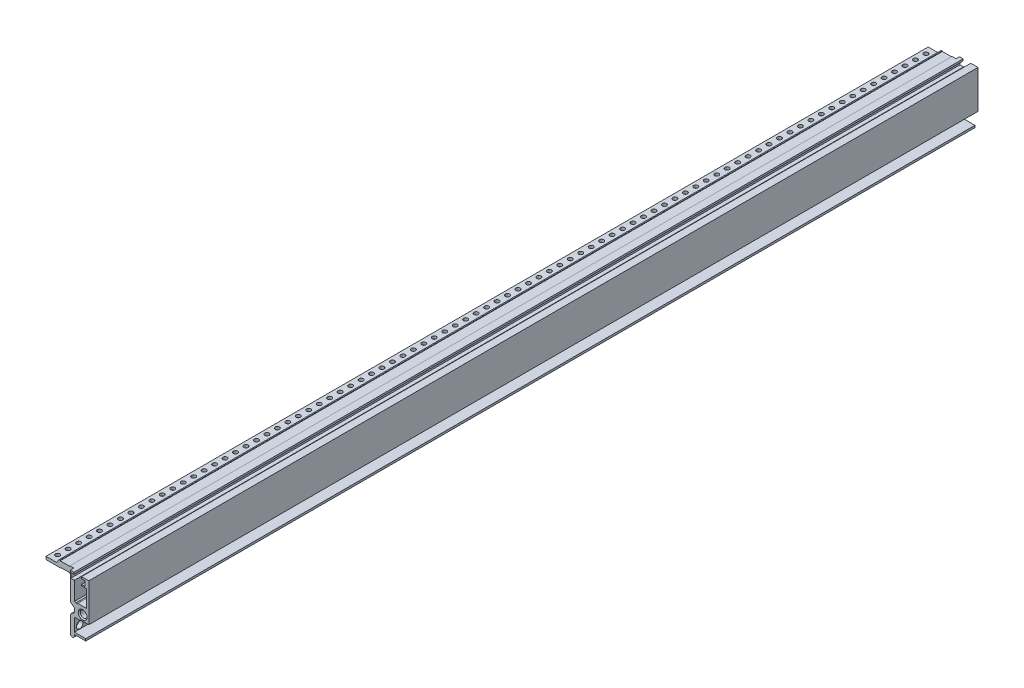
SolidWorks part; units mm, degrees
ref_plane "前视基准面" through (0, 0, 0) normal (0, 0, 1) x (1, 0, 0)
ref_plane "上视基准面" through (0, 0, 0) normal (0, 1, 0) x (1, 0, 0)
ref_plane "右视基准面" through (0, 0, 0) normal (1, 0, 0) x (0, 0, -1)
sketch "Model" plane through (0, 0, 0) normal (0, 0, 1) x (1, 0, 0)
  line L0 (2281.8705, 1522.2598) -> (2281.8705, 1503.7598)
  line L1 (2277.6705, 1503.7598) -> (2277.6705, 1503.4598)
  line L2 (2280.6205, 1518.3598) -> (2280.6205, 1510.0598)
  line L3 (2278.3705, 1522.2598) -> (2278.3705, 1521.3598)
  line L4 (2274.6705, 1522.2598) -> (2274.6705, 1521.3598)
  line L5 (2270.9705, 1522.2598) -> (2270.9705, 1522.0098)
  line L6 (2281.8705, 1522.2598) -> (2278.3705, 1522.2598)
  line L7 (2281.8705, 1503.7598) -> (2277.6705, 1503.7598)
  line L8 (2280.3705, 1496.1598) -> (2274.8705, 1496.1598)
  line L9 (2280.3705, 1497.1598) -> (2274.8705, 1497.1598)
  line L10 (2280.6205, 1518.3598) -> (2278.2705, 1518.3598)
  line L11 (2280.6205, 1510.0598) -> (2276.5105, 1510.0598)
  line L12 (2275.8305, 1510.0598) -> (2274.8705, 1510.0598)
  line L13 (2279.9205, 1518.9598) -> (2278.2705, 1518.9598)
  line L14 (2279.9205, 1521.3598) -> (2278.3705, 1521.3598)
  line L15 (2274.6705, 1522.2598) -> (2270.9705, 1522.2598)
  line L16 (2266.5705, 1519.0598) -> (2259.3705, 1519.0598)
  line L17 (2270.9705, 1519.3098) -> (2266.5705, 1519.3098)
  line L18 (2264.5705, 1520.4598) -> (2259.3705, 1520.4598)
  line L19 (2270.9705, 1522.0098) -> (2266.2705, 1522.0098)
  line L20 (2259.3705, 1520.4598) -> (2259.3705, 1519.0598)
  line L21 (2266.5705, 1519.3098) -> (2266.5705, 1519.0598)
  line L22 (2266.2705, 1522.2598) -> (2266.2705, 1522.0098)
  line L23 (2266.2705, 1522.2598) -> (2265.7705, 1522.2598)
  line L24 (2272.8705, 1516.5598) -> (2272.8705, 1508.9598)
  line L25 (2272.8705, 1503.7598) -> (2272.8705, 1495.5598)
  line L26 (2280.3705, 1497.1598) -> (2280.3705, 1496.1598)
  line L27 (2274.8705, 1496.1598) -> (2274.8705, 1495.5598)
  line L28 (2274.8705, 1507.3598) -> (2274.8705, 1505.3598)
  line L29 (2274.6705, 1521.3598) -> (2273.1205, 1521.3598)
  line L30 (2279.9205, 1521.3598) -> (2279.9205, 1518.9598)
  line L31 (2273.1205, 1521.3598) -> (2273.1205, 1518.9598)
  line L32 (2274.8705, 1518.9598) -> (2273.1205, 1518.9598)
  line L33 (2270.9705, 1519.3098) -> (2270.9705, 1519.0598)
  line L34 (2278.2705, 1518.9598) -> (2278.2705, 1518.3598)
  line L35 (2272.8705, 1508.9598) -> (2274.8705, 1507.3598)
  line L36 (2274.8705, 1505.3598) -> (2272.8705, 1503.7598)
  line L37 (2274.8705, 1518.9598) -> (2274.8705, 1510.0598)
  line L38 (2277.6705, 1503.4598) -> (2274.8705, 1503.4598)
  line L39 (2274.8705, 1497.1598) -> (2274.8705, 1503.4598)
  line L43 (2264.5705, 1520.4598) -> (2265.7705, 1522.2598)
  line L44 (2270.9705, 1519.0598) -> (2272.8705, 1516.5598)
  arc A0 (2275.8305, 1510.0598) -> (2276.5105, 1510.0598) centre (2276.1705, 1510.0598) ccw
  arc A1 (2272.8705, 1495.5598) -> (2274.8705, 1495.5598) centre (2273.8705, 1495.5598) ccw
extrude "凸台-拉伸1" add sketch "Model" along normal blind 431.8
hole_wizard "M4 螺纹孔1" positions "草图3" profile "草图2" tap size "M4" standard "Gb"
sketch "草图3" plane through (0, 0, 431.8) normal (0, 0, 1) x (1, 0, 0)
  line L0 (2281.8705, 1503.7598) -> (2281.8705, 1522.2598) construction
  line L1 (2281.8705, 1522.2598) -> (2278.3705, 1522.2598) construction
  point P0 (2278.8705, 1506.4598)
  dimension "D1" = 3
  dimension "D2" = 15.8
sketch "草图2" plane through (2278.8705, 1506.4598, 431.8) normal (1, 0, 0) x (0, -1, 0)
  line L0 (0, 0) -> (0, 24.4914)
  line L1 (0, 24.4914) -> (1.65, 23.5)
  line L2 (1.65, 23.5) -> (1.65, 0)
  line L5 (1.65, 0) -> (0, 0)
  line L10 (0, 24.4914) -> (-1.65, 23.5) construction
  line L11 (0, -6.35) -> (0, 107.95) construction
  dimension "螺纹孔钻头直径" = 3.3
  dimension "螺纹孔钻头深度" = 23.5
  dimension "导头角度" = 118
hole_wizard "M4 螺纹孔2" positions "草图5" profile "草图4" tap size "M4" standard "Gb"
sketch "草图5" plane through (0, 0, 0) normal (0, 0, -1) x (-1, 0, 0)
  line L0 (-2281.8705, 1503.7598) -> (-2281.8705, 1522.2598) construction
  line L1 (-2281.8705, 1522.2598) -> (-2278.3705, 1522.2598) construction
  point P0 (-2278.8705, 1506.4598)
  dimension "D1" = 3
  dimension "D2" = 15.8
sketch "草图4" plane through (2278.8705, 1506.4598, 0) normal (1, 0, 0) x (0, 1, 0)
  line L0 (0, 0) -> (0, 24.4914)
  line L1 (0, 24.4914) -> (1.65, 23.5)
  line L2 (1.65, 23.5) -> (1.65, 0)
  line L5 (1.65, 0) -> (0, 0)
  line L10 (0, 24.4914) -> (-1.65, 23.5) construction
  line L11 (0, -6.35) -> (0, 107.95) construction
  dimension "螺纹孔钻头直径" = 3.3
  dimension "螺纹孔钻头深度" = 23.5
  dimension "导头角度" = 118
chamfer "倒角1" distance 0.5 angle 45 2 edges at (2277.2205, 1506.4598, 0) (2280.5205, 1506.4598, 431.8)
sketch "草图6" plane through (2272.8705, 0, 0) normal (-1, 0, 0) x (0, 0, 1)
  line L0 (431.8, 1503.7598) -> (431.8, 1495.5598) construction
  line L1 (431.8, 1522.2598) -> (0, 1522.2598) construction
  circle A0 centre (429.26, 1498.9598) radius 1.65
  circle A1 centre (424.18, 1498.9598) radius 1.65
  circle A2 centre (419.1, 1498.9598) radius 1.65
  circle A3 centre (414.02, 1498.9598) radius 1.65
  circle A4 centre (408.94, 1498.9598) radius 1.65
  circle A5 centre (403.86, 1498.9598) radius 1.65
  circle A6 centre (398.78, 1498.9598) radius 1.65
  circle A7 centre (393.7, 1498.9598) radius 1.65
  circle A8 centre (388.62, 1498.9598) radius 1.65
  circle A9 centre (383.54, 1498.9598) radius 1.65
  circle A10 centre (378.46, 1498.9598) radius 1.65
  circle A11 centre (373.38, 1498.9598) radius 1.65
  circle A12 centre (368.3, 1498.9598) radius 1.65
  circle A13 centre (363.22, 1498.9598) radius 1.65
  circle A14 centre (358.14, 1498.9598) radius 1.65
  circle A15 centre (353.06, 1498.9598) radius 1.65
  circle A16 centre (347.98, 1498.9598) radius 1.65
  circle A17 centre (342.9, 1498.9598) radius 1.65
  circle A18 centre (337.82, 1498.9598) radius 1.65
  circle A19 centre (332.74, 1498.9598) radius 1.65
  circle A20 centre (327.66, 1498.9598) radius 1.65
  circle A21 centre (322.58, 1498.9598) radius 1.65
  circle A22 centre (317.5, 1498.9598) radius 1.65
  circle A23 centre (312.42, 1498.9598) radius 1.65
  circle A24 centre (307.34, 1498.9598) radius 1.65
  circle A25 centre (302.26, 1498.9598) radius 1.65
  circle A26 centre (297.18, 1498.9598) radius 1.65
  circle A27 centre (292.1, 1498.9598) radius 1.65
  circle A28 centre (287.02, 1498.9598) radius 1.65
  circle A29 centre (281.94, 1498.9598) radius 1.65
  circle A30 centre (276.86, 1498.9598) radius 1.65
  circle A31 centre (271.78, 1498.9598) radius 1.65
  circle A32 centre (266.7, 1498.9598) radius 1.65
  circle A33 centre (261.62, 1498.9598) radius 1.65
  circle A34 centre (256.54, 1498.9598) radius 1.65
  circle A35 centre (251.46, 1498.9598) radius 1.65
  circle A36 centre (246.38, 1498.9598) radius 1.65
  circle A37 centre (241.3, 1498.9598) radius 1.65
  circle A38 centre (236.22, 1498.9598) radius 1.65
  circle A39 centre (231.14, 1498.9598) radius 1.65
  circle A40 centre (226.06, 1498.9598) radius 1.65
  circle A41 centre (220.98, 1498.9598) radius 1.65
  circle A42 centre (215.9, 1498.9598) radius 1.65
  circle A43 centre (210.82, 1498.9598) radius 1.65
  circle A44 centre (205.74, 1498.9598) radius 1.65
  circle A45 centre (200.66, 1498.9598) radius 1.65
  circle A46 centre (195.58, 1498.9598) radius 1.65
  circle A47 centre (190.5, 1498.9598) radius 1.65
  circle A48 centre (185.42, 1498.9598) radius 1.65
  circle A49 centre (180.34, 1498.9598) radius 1.65
  circle A50 centre (175.26, 1498.9598) radius 1.65
  circle A51 centre (170.18, 1498.9598) radius 1.65
  circle A52 centre (165.1, 1498.9598) radius 1.65
  circle A53 centre (160.02, 1498.9598) radius 1.65
  circle A54 centre (154.94, 1498.9598) radius 1.65
  circle A55 centre (149.86, 1498.9598) radius 1.65
  circle A56 centre (144.78, 1498.9598) radius 1.65
  circle A57 centre (139.7, 1498.9598) radius 1.65
  circle A58 centre (134.62, 1498.9598) radius 1.65
  circle A59 centre (129.54, 1498.9598) radius 1.65
  circle A60 centre (124.46, 1498.9598) radius 1.65
  circle A61 centre (119.38, 1498.9598) radius 1.65
  circle A62 centre (114.3, 1498.9598) radius 1.65
  circle A63 centre (109.22, 1498.9598) radius 1.65
  circle A64 centre (104.14, 1498.9598) radius 1.65
  circle A65 centre (99.06, 1498.9598) radius 1.65
  circle A66 centre (93.98, 1498.9598) radius 1.65
  circle A67 centre (88.9, 1498.9598) radius 1.65
  circle A68 centre (83.82, 1498.9598) radius 1.65
  circle A69 centre (78.74, 1498.9598) radius 1.65
  circle A70 centre (73.66, 1498.9598) radius 1.65
  circle A71 centre (68.58, 1498.9598) radius 1.65
  circle A72 centre (63.5, 1498.9598) radius 1.65
  circle A73 centre (58.42, 1498.9598) radius 1.65
  circle A74 centre (53.34, 1498.9598) radius 1.65
  circle A75 centre (48.26, 1498.9598) radius 1.65
  circle A76 centre (43.18, 1498.9598) radius 1.65
  circle A77 centre (38.1, 1498.9598) radius 1.65
  circle A78 centre (33.02, 1498.9598) radius 1.65
  circle A79 centre (27.94, 1498.9598) radius 1.65
  circle A80 centre (22.86, 1498.9598) radius 1.65
  circle A81 centre (17.78, 1498.9598) radius 1.65
  circle A82 centre (12.7, 1498.9598) radius 1.65
  circle A83 centre (7.62, 1498.9598) radius 1.65
  circle A84 centre (2.54, 1498.9598) radius 1.65
extrude "切除-拉伸1" cut sketch "草图6" against normal blind 10
hole_wizard "M2.5 螺纹孔1"
sketch "草图8" plane through (0, 1520.4598, 0) normal (0, 1, 0) x (1, 0, 0)
  line L0 (2264.5705, -431.8) -> (2259.3705, -431.8) construction
  line L1 (2259.3705, -431.8) -> (2259.3705, 0) construction
  line L2 (2264.5705, 0) -> (2259.3705, 0) construction
  point P0 (2261.6705, -426.72)
  point P13 (2261.6705, -421.64)
  point P14 (2261.6705, -416.56)
  point P15 (2261.6705, -411.48)
  point P16 (2261.6705, -406.4)
  point P17 (2261.6705, -401.32)
  point P18 (2261.6705, -396.24)
  point P19 (2261.6705, -391.16)
  point P20 (2261.6705, -386.08)
  point P21 (2261.6705, -381)
  point P22 (2261.6705, -375.92)
  point P23 (2261.6705, -370.84)
  point P24 (2261.6705, -365.76)
  point P25 (2261.6705, -360.68)
  point P26 (2261.6705, -355.6)
  point P27 (2261.6705, -350.52)
  point P28 (2261.6705, -345.44)
  point P29 (2261.6705, -340.36)
  point P30 (2261.6705, -335.28)
  point P31 (2261.6705, -330.2)
  point P32 (2261.6705, -325.12)
  point P33 (2261.6705, -320.04)
  point P34 (2261.6705, -314.96)
  point P35 (2261.6705, -309.88)
  point P36 (2261.6705, -304.8)
  point P37 (2261.6705, -299.72)
  point P38 (2261.6705, -294.64)
  point P39 (2261.6705, -289.56)
  point P40 (2261.6705, -284.48)
  point P41 (2261.6705, -279.4)
  point P42 (2261.6705, -274.32)
  point P43 (2261.6705, -269.24)
  point P44 (2261.6705, -264.16)
  point P45 (2261.6705, -259.08)
  point P46 (2261.6705, -254)
  point P47 (2261.6705, -248.92)
  point P48 (2261.6705, -243.84)
  point P49 (2261.6705, -238.76)
  point P50 (2261.6705, -233.68)
  point P51 (2261.6705, -228.6)
  point P52 (2261.6705, -223.52)
  point P53 (2261.6705, -218.44)
  point P54 (2261.6705, -213.36)
  point P55 (2261.6705, -208.28)
  point P56 (2261.6705, -203.2)
  point P57 (2261.6705, -198.12)
  point P58 (2261.6705, -193.04)
  point P59 (2261.6705, -187.96)
  point P60 (2261.6705, -182.88)
  point P61 (2261.6705, -177.8)
  point P62 (2261.6705, -172.72)
  point P63 (2261.6705, -167.64)
  point P64 (2261.6705, -162.56)
  point P65 (2261.6705, -157.48)
  point P66 (2261.6705, -152.4)
  point P67 (2261.6705, -147.32)
  point P68 (2261.6705, -142.24)
  point P69 (2261.6705, -137.16)
  point P70 (2261.6705, -132.08)
  point P71 (2261.6705, -127)
  point P72 (2261.6705, -121.92)
  point P73 (2261.6705, -116.84)
  point P74 (2261.6705, -111.76)
  point P75 (2261.6705, -106.68)
  point P76 (2261.6705, -101.6)
  point P77 (2261.6705, -96.52)
  point P78 (2261.6705, -91.44)
  point P79 (2261.6705, -86.36)
  point P80 (2261.6705, -81.28)
  point P81 (2261.6705, -76.2)
  point P82 (2261.6705, -71.12)
  point P83 (2261.6705, -66.04)
  point P84 (2261.6705, -60.96)
  point P85 (2261.6705, -55.88)
  point P86 (2261.6705, -50.8)
  point P87 (2261.6705, -45.72)
  point P88 (2261.6705, -40.64)
  point P89 (2261.6705, -35.56)
  point P90 (2261.6705, -30.48)
  point P91 (2261.6705, -25.4)
  point P92 (2261.6705, -20.32)
  point P93 (2261.6705, -15.24)
  point P94 (2261.6705, -10.16)
  point P95 (2261.6705, -5.08)
  dimension "D1" = 5.08
  dimension "D2" = 2.3
  dimension "D4" = 5.08
  dimension "D3" = 84
sketch "草图7" plane through (2261.6705, 1520.4598, 426.72) normal (1, 0, 0) x (0, 0, 1)
  line L0 (0, 0) -> (0, 7.8659)
  line L1 (0, 7.8659) -> (1.025, 7.25)
  line L2 (1.025, 7.25) -> (1.025, 0)
  line L5 (1.025, 0) -> (0, 0)
  line L10 (0, 7.8659) -> (-1.025, 7.25) construction
  line L11 (0, -6.35) -> (0, 107.95) construction
  dimension "螺纹孔钻头直径" = 2.05
  dimension "螺纹孔钻头深度" = 7.25
  dimension "导头角度" = 118
sketch "草图9" plane through (0, 1519.0598, 0) normal (0, -1, 0) x (1, 0, 0)
  line L0 (2272.8705, 431.8) -> (2272.8705, 0) construction
  line L2 (2259.3705, 431.8) -> (2272.8705, 431.8)
  line L3 (2259.3705, 431.8) -> (2259.3705, 430.1)
  line L4 (2259.3705, 430.1) -> (2272.8705, 430.1)
  line L5 (2272.8705, 431.8) -> (2272.8705, 430.1)
  line L6 (2259.3705, 0) -> (2272.8705, 0)
  line L7 (2259.3705, 0) -> (2259.3705, 1.7)
  line L8 (2259.3705, 1.7) -> (2272.8705, 1.7)
  line L9 (2272.8705, 0) -> (2272.8705, 1.7)
  dimension "D1" = 1.7
  dimension "D2" = 1.7
extrude "切除-拉伸2" cut sketch "草图9" against normal through all and the other way through all
equation "\"D4@草图6\"=\"D1@凸台-拉伸1\"/5.08"
